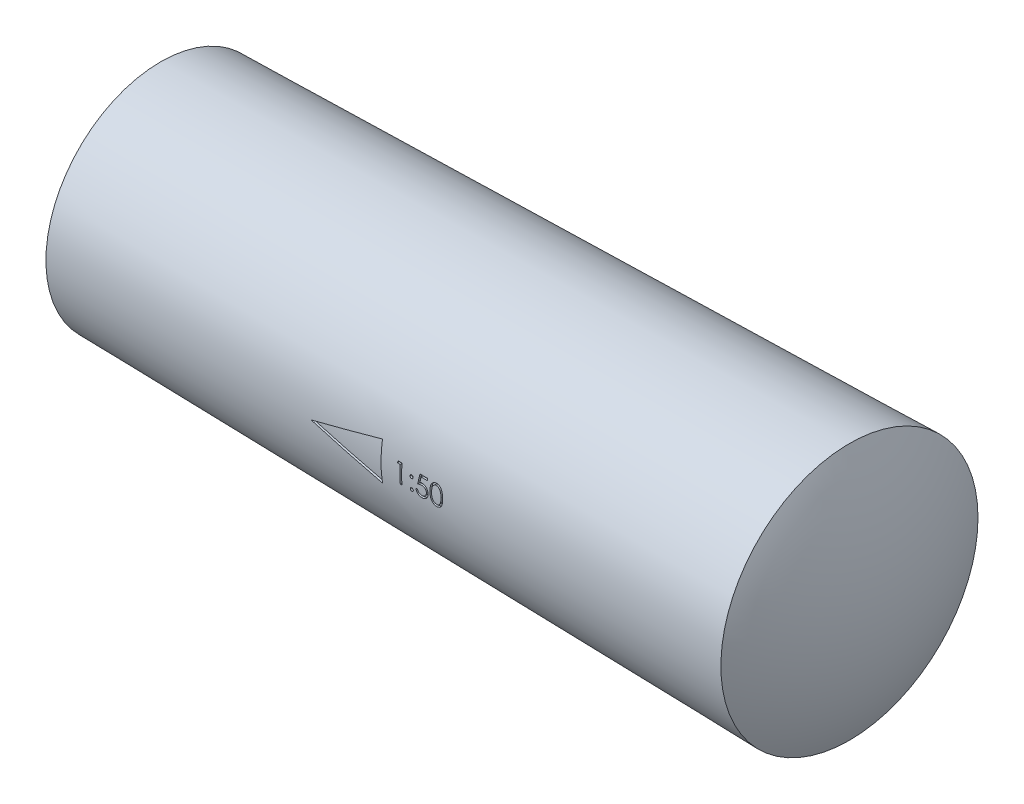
SolidWorks part; units mm, degrees
ref_plane "Front Plane" through (0, 0, 0) normal (0, 0, 1) x (1, 0, 0)
ref_plane "Top Plane" through (0, 0, 0) normal (0, 1, 0) x (1, 0, 0)
ref_plane "Right Plane" through (0, 0, 0) normal (1, 0, 0) x (0, 0, -1)
sketch "Sketch1" plane through (0, 0, 0) normal (1, 0, 0) x (0, 0, -1)
  circle A0 centre (0, 0) radius 6
  dimension "D1" = 12
extrude "Extrude1" add sketch "Sketch1" along normal mid plane 36
draft "Draft1" type of draft neutral plane draft angle 1.146 faces to draft 1 parameters "D1"=1.146
sketch "Sketch2" plane through (0, 0, 0) normal (0, 0, 1) x (1, 0, 0)
  line L0 (-18, 0) -> (-18, 6)
  line L1 (-18, 6) -> (-18, -6) construction
  line L2 (-18, 0) -> (-19.6, 0)
  line L3 (-19.6, 0) -> (-19.6, -6.36) construction
  line L4 (18, 0) -> (18, 6.72)
  line L5 (18, -6.72) -> (18, 6.72) construction
  line L6 (18, 0) -> (19.6, 0)
  line L7 (19.6, 0) -> (19.6, -6.36) construction
  line L8 (-18, -6) -> (18, -6.72) construction
  arc A0 (-19.6, 0) -> (-18, 6) centre (-7.55, 0) cw
  arc A1 (19.6, 0) -> (18, 6.72) centre (4.6879, 0) ccw
  point P14 (0, -6.36)
revolve "Revolve1" add sketch "Sketch2" angle 360 about L2
sketch "Sketch5" plane through (0, 0, 0) normal (0, 0, 1) x (1, 0, 0)
  line L0 (0, 6.36) -> (0, -6.36) construction
  line L1 (18, 6.72) -> (-18, 6) construction
  line L2 (-18, -6) -> (18, -6.72) construction
ref_plane "Plane2" through (0, 0, 0) normal (-0.02, 0, 0.9998) x (0.9998, 0, 0.02)
sketch "Sketch6" plane through (0, 0, 0) normal (-0.02, 0, 0.9998) x (0.9998, 0, 0.02)
  line L0 (0, 0) -> (0, 1)
  line L1 (0, 6.36) -> (0, -6.36) construction
  line L2 (0, 1) -> (-3.7321, 0)
  line L3 (-3.7321, 0) -> (0, -1)
  line L4 (0, -1) -> (0, 0)
  line L5 (0, -0.5) -> (4, -0.5) construction
  text T0 "1:50" font "Century Gothic" height 1
  dimension "D1" = 2
  dimension "D2" = 30
  dimension "D3" = 4
wrap "Wrap2" sketch "Sketch6" wrap type deboss source sketch "Sketch6" thickness 0.1 parameters "D1"=0.1
equation "\"D2@Sketch2\" = \"D1@Sketch2\""
